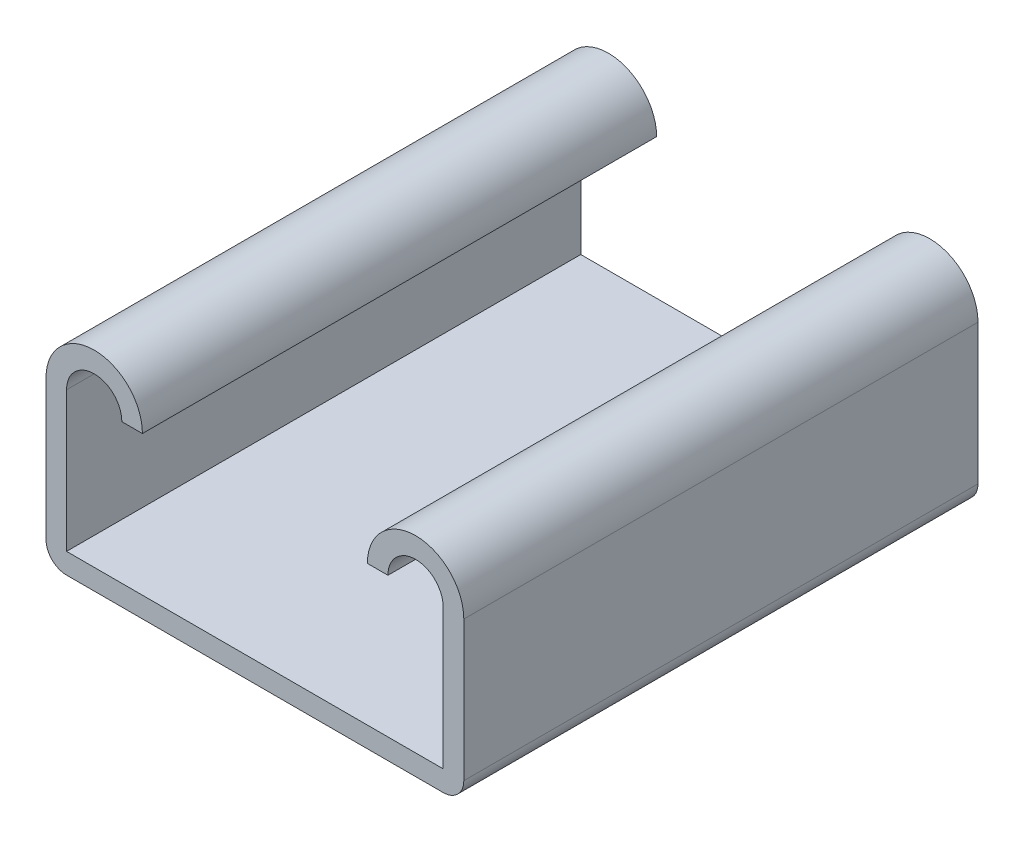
SolidWorks part; units mm, degrees
ref_plane "Plane1" through (0, 0, 0) normal (0, 0, 1) x (1, 0, 0)
ref_plane "Plane2" through (0, 0, 0) normal (0, 1, 0) x (1, 0, 0)
ref_plane "Plane3" through (0, 0, 0) normal (1, 0, 0) x (0, 0, -1)
sketch "Sketch1" plane through (0, 0, 0) normal (0, 0, 1) x (1, 0, 0)
  line L0 (-10.3188, 3.7909) -> (-10.3188, -3.1242)
  line L1 (-9.3027, -4.1402) -> (9.3028, -4.1402)
  line L2 (10.3188, -3.1242) -> (10.3188, 3.7909)
  line L3 (-6.5723, 3.7909) -> (-5.5563, 3.7909)
  line L4 (5.5562, 3.7909) -> (6.5722, 3.7909)
  line L6 (-9.3028, 3.7909) -> (-9.3027, -3.1242)
  line L7 (-9.3027, -3.1242) -> (9.3027, -3.1242)
  line L8 (9.3027, -3.1242) -> (9.3027, 3.7909)
  line L10 (-25.4, 6.1722) -> (25.4, 6.1722) construction
  arc A0 (10.3188, 3.7909) -> (5.5562, 3.7909) centre (7.9375, 3.7909) ccw
  arc A1 (-10.3188, 3.7909) -> (-5.5563, 3.7909) centre (-7.9375, 3.7909) cw
  arc A2 (-9.3027, -4.1402) -> (-10.3188, -3.1242) centre (-9.3027, -3.1242) cw
  arc A3 (9.3028, -4.1402) -> (10.3188, -3.1242) centre (9.3028, -3.1242) ccw
  arc A4 (-9.3028, 3.7909) -> (-6.5723, 3.7909) centre (-7.9375, 3.7909) cw
  arc A5 (9.3027, 3.7909) -> (6.5722, 3.7909) centre (7.9375, 3.7909) ccw
  dimension "D1" = 1.016
  dimension "D3" = 10.3187
  dimension "D4" = 1.016
  dimension "Width" = 20.6375
  dimension "D5" = 4.1402
  dimension "D6" = 11.1125
  dimension "D7" = 4.7625
  dimension "D8" = 6.1722
  dimension "D2" = 4.7625
  dimension "gauge" = 1.016
extrude "Base-Extrude" add sketch "Sketch1" along normal mid plane 25.4
equation "\"D3@Sketch1\" = \"Width@Sketch1\" / 2"
equation "\"D1@Sketch1\" = \"gauge@Sketch1\""
